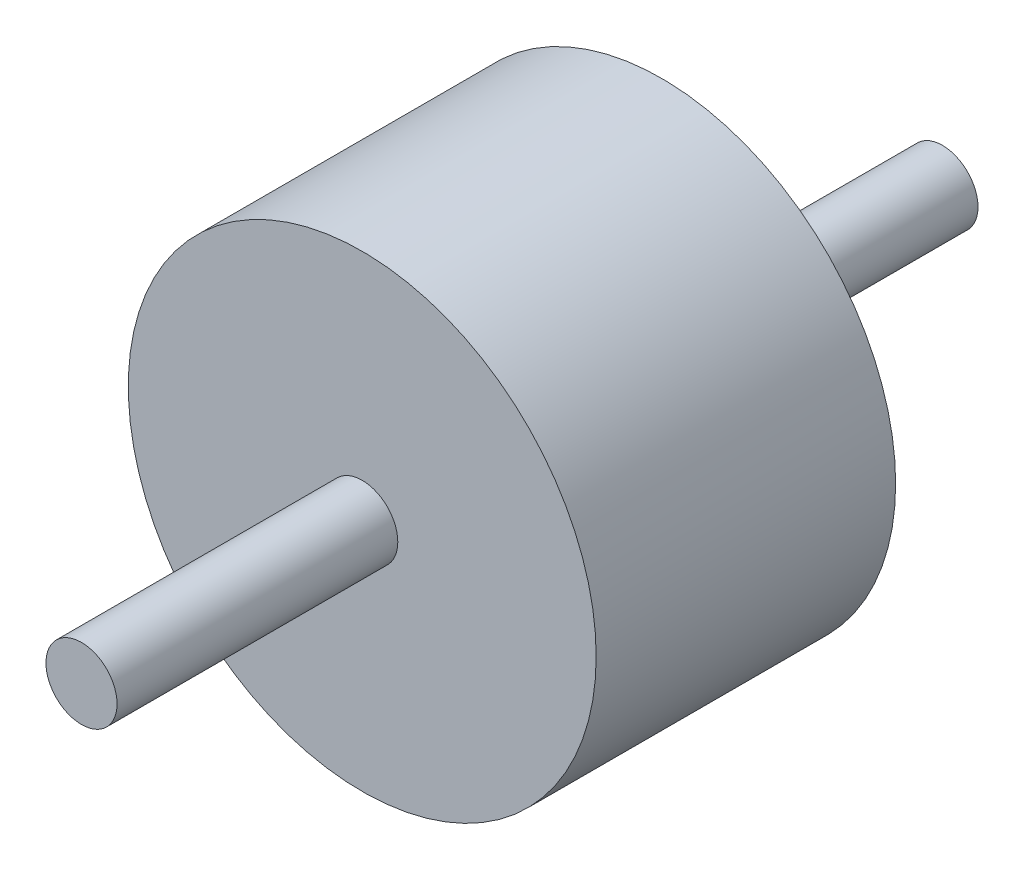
SolidWorks part; units mm, degrees
ref_plane "前视" through (0, 0, 0) normal (0, 0, 1) x (1, 0, 0)
ref_plane "上视" through (0, 0, 0) normal (0, 1, 0) x (1, 0, 0)
ref_plane "右视" through (0, 0, 0) normal (1, 0, 0) x (0, 0, -1)
sketch "草图1" plane through (0, 0, 0) normal (0, 0, 1) x (1, 0, 0)
  circle A0 centre (0, 0) radius 1.25
  dimension "D1" = 2.5
extrude "凸台-拉伸1" add sketch "草图1" along normal blind 1.6
sketch "草图2" plane through (0, 0, 1.6) normal (0, 0, 1) x (1, 0, 0)
  circle A0 centre (0, 0) radius 0.19
  dimension "D1" = 0.38
extrude "凸台-拉伸2" add sketch "草图2" along normal blind 1.5
sketch "草图3" plane through (0, 0, 0) normal (0, 0, -1) x (-1, 0, 0)
  circle A0 centre (0, 0) radius 0.19
  dimension "D1" = 0.38
extrude "凸台-拉伸3" add sketch "草图3" along normal blind 1.5
